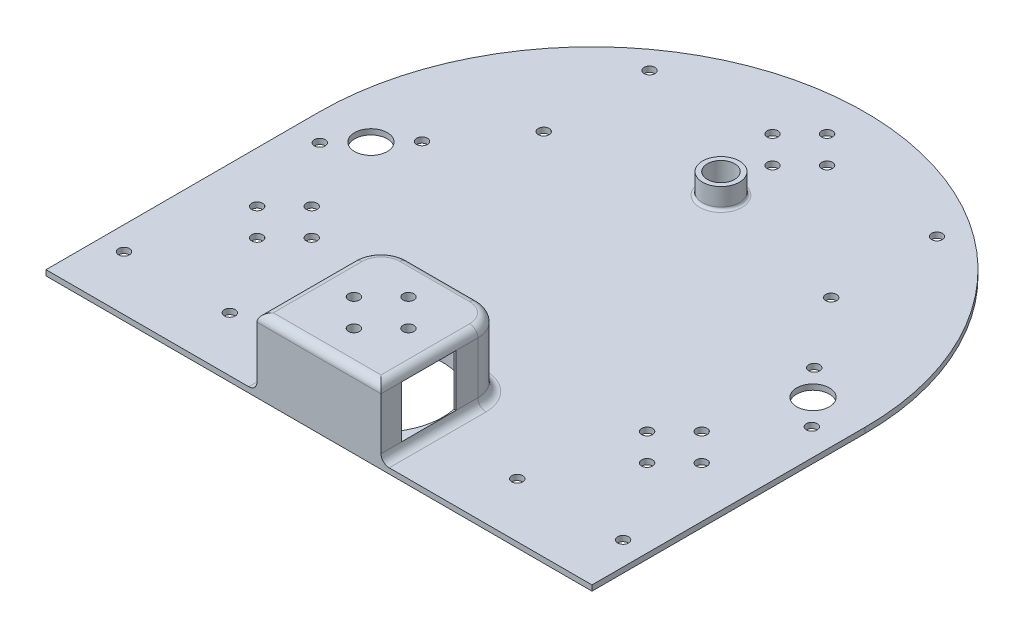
SolidWorks part; units mm, degrees
ref_plane "Front Plane" through (0, 0, 0) normal (0, 0, 1) x (1, 0, 0)
ref_plane "Top Plane" through (0, 0, 0) normal (0, 1, 0) x (1, 0, 0)
ref_plane "Right Plane" through (0, 0, 0) normal (1, 0, 0) x (0, 0, -1)
sketch "Sketch1" plane through (0, 0, 0) normal (0, 1, 0) x (1, 0, 0)
  line L0 (-100.1, 0) -> (-100.1, -100.1)
  line L1 (-100.1, -100.1) -> (100.1, -100.1)
  line L2 (100.1, -100.1) -> (100.1, 0)
  arc A0 (100.1, 0) -> (-100.1, 0) centre (0, 0) ccw
  dimension "D1" = 200.2
extrude "Boss-Extrude1" add sketch "Sketch1" along normal blind 2
sketch "Sketch2" plane through (0, 2, 0) normal (0, 1, 0) x (1, 0, 0)
  line L0 (0, 0) -> (0, 100.1) construction
  line L1 (0, 0) -> (-100.1, -57.7928) construction
  line L2 (-100.1, 0) -> (-100.1, -100.1) construction
  line L3 (0, 0) -> (100.1, -57.7928) construction
  line L4 (100.1, -100.1) -> (100.1, 0) construction
  line L5 (-100.1, 0) -> (100.1, 0) construction
  line L6 (0, 0) -> (0, -100.1) construction
  line L7 (-100.1, -100.1) -> (100.1, -100.1) construction
  arc A0 (100.1, 0) -> (-100.1, 0) centre (0, 0) ccw construction
  circle A1 centre (0, 76.2) radius 10
  circle A2 centre (71.4904, -41.275) radius 10
  circle A3 centre (-71.4904, -41.275) radius 10
  circle A4 centre (-71.4904, -31.275) radius 2
  circle A5 centre (-61.4904, -41.275) radius 2
  circle A6 centre (-71.4904, -51.275) radius 2
  circle A7 centre (-81.4904, -41.275) radius 2
  circle A8 centre (61.4904, -41.275) radius 2
  circle A9 centre (71.4904, -31.275) radius 2
  circle A10 centre (81.4904, -41.275) radius 2
  circle A11 centre (71.4904, -51.275) radius 2
  circle A12 centre (0, 66.2) radius 2
  circle A13 centre (-10, 76.2) radius 2
  circle A14 centre (0, 86.2) radius 2
  circle A15 centre (10, 76.2) radius 2
  circle A16 centre (-81.05, 0) radius 6
  circle A17 centre (81.05, 0) radius 6
  circle A18 centre (0, -77.2975) radius 10
  circle A19 centre (0, -67.2975) radius 2
  circle A20 centre (10, -77.2975) radius 2
  circle A21 centre (0, -87.2975) radius 2
  circle A22 centre (-10, -77.2975) radius 2
  dimension "D3" = 4
  dimension "D7" = 20
  dimension "D8" = 12
  dimension "D12" = 20
  dimension "D13" = 4
  dimension "D1" = 120
  dimension "D2" = 120
  dimension "D4" = 76.2
  dimension "D5" = 82.55
  dimension "D6" = 82.55
  dimension "D9" = 19.05
  dimension "D10" = 19.05
  dimension "D11" = 112
extrude "Cut-Extrude1" cut sketch "Sketch2" against normal blind 5 contours A3 A7 | A3 A6 | A3 A6 | A3 A5 | A3 A5 | A3 A4 | A3 A4 | A16 | A17 | A2 A11 | A2 A11 | A2 A10 | A2 A10 | A2 A8 | A2 A8 | A2 A9 | A2 A9 | A1 A14 | A1 A14 | A1 A15 | A1 A15 | A1 A12 | A1 A12 | A1 A13 | A1 A13 | A20 | A19 | A22 | A21
sketch "Sketch4" plane through (0, 2, 0) normal (0, 1, 0) x (1, 0, 0)
  line L0 (0, 0) -> (0, 100.1) construction
  arc A0 (100.1, 0) -> (-100.1, 0) centre (0, 0) ccw construction
  circle A1 centre (0, 47.3) radius 5
  dimension "D1" = 10
  dimension "D2" = 52.8
extrude "Cut-Extrude2" cut sketch "Sketch4" against normal blind 5
sketch "Sketch5" plane through (0, 2, 0) normal (0, 1, 0) x (1, 0, 0)
  circle A0 centre (0, 47.3) radius 5
  circle A1 centre (0, 47.3) radius 6.75
  dimension "D1" = 10
  dimension "D2" = 13.5
extrude "Boss-Extrude2" add sketch "Sketch5" along normal mid plane 15
sketch "Sketch8" plane through (0, 2, 0) normal (0, 1, 0) x (1, 0, 0)
  line L0 (-81.05, 0) -> (-70.5251, 11.0358) construction
  line L1 (-81.05, 0) -> (-91.5749, -11.0358) construction
  line L2 (-10, -77.2975) -> (10, -77.2975) construction
  line L3 (0, -67.2975) -> (0, -87.2975) construction
  line L4 (-81.05, 0) -> (0, -77.2975) construction
  line L5 (81.05, 0) -> (0, -77.2975) construction
  line L6 (81.05, 0) -> (91.5749, -11.0358) construction
  line L7 (81.05, 0) -> (70.5251, 11.0358) construction
  circle A0 centre (-71.9054, 9.5885) radius 2
  circle A1 centre (-90.1946, -9.5885) radius 2
  circle A2 centre (71.9054, 9.5885) radius 2
  circle A3 centre (90.1946, -9.5885) radius 2
  dimension "D2" = 4
  dimension "D1" = 13.25
extrude "Cut-Extrude3" cut sketch "Sketch8" against normal through all
sketch "Sketch9" plane through (0, 2, 0) normal (0, 1, 0) x (1, 0, 0)
  line L0 (0, -67.2975) -> (0, -87.2975) construction
  line L1 (-10, -77.2975) -> (10, -77.2975) construction
  circle A0 centre (0, -77.2975) radius 22.5
  dimension "D1" = 45
extrude "Cut-Extrude4" cut sketch "Sketch9" against normal through all
sketch "Sketch10" plane through (0, 2, 0) normal (0, 1, 0) x (1, 0, 0)
  line L0 (-100.1, -100.1) -> (100.1, -100.1) construction
  line L1 (-22.75, -64.6) -> (-22.75, -100.1)
  line L2 (22.75, -64.6) -> (22.75, -100.1)
  line L3 (-22.75, -100.1) -> (22.75, -100.1)
  line L4 (-12.75, -54.6) -> (12.75, -54.6)
  arc A0 (-22.75, -64.6) -> (-12.75, -54.6) centre (-12.75, -64.6) cw
  arc A1 (22.75, -64.6) -> (12.75, -54.6) centre (12.75, -64.6) ccw
  point P0 (0, -54.6)
  point P9 (-22.75, -54.6)
  point P13 (22.75, -54.6)
  dimension "D3" = 10
  dimension "D1" = 45.5
  dimension "D2" = 45.5
extrude "Boss-Extrude3" add sketch "Sketch10" along normal blind 25
sketch "Sketch11" plane through (0, 2, 0) normal (0, -1, 0) x (1, 0, 0)
  circle A0 centre (0, 77.2975) radius 22.5
extrude "Cut-Extrude5" cut sketch "Sketch11" against normal blind 21
sketch "Sketch12" plane through (0, 23, 0) normal (0, -1, 0) x (1, 0, 0)
  circle A0 centre (0, 77.2975) radius 10
  circle A1 centre (0, 87.2975) radius 2
  circle A2 centre (10, 77.2975) radius 2
  circle A3 centre (0, 67.2975) radius 2
  circle A4 centre (-10, 77.2975) radius 2
  dimension "D1" = 20
  dimension "D2" = 4
extrude "Cut-Extrude6" cut sketch "Sketch12" against normal blind 20 contours A0 A4 | A0 A4 | A0 A3 | A0 A3 | A0 A2 | A0 A2 | A0 A1 | A0 A1
fillet "Fillet3" radius 3 11 edges at (-22.75, 2, 82.35) (22.75, 2, 82.35) (0, 2, 54.6) (-22.75, 27, 82.35) (0, 27, 54.6) (22.75, 27, 82.35) (0, 27, 100.1) (19.8211, 2, 57.5289) (-19.8211, 2, 57.5289) (-19.8211, 27, 57.5289) (19.8211, 27, 57.5289)
fillet "Fillet5" radius 1 2 edges at (0, 2, -40.55) (0, 0, -40.55)
sketch "Sketch15" plane through (0, 2, 0) normal (0, 1, 0) x (1, 0, 0)
  line L0 (-91.5, -80.1) -> (-52.7, -80.1) construction
  line L1 (0, 0) -> (0, -100.1) construction
  line L2 (22.75, -100.1) -> (-22.75, -100.1) construction
  line L3 (-100.1, -100.1) -> (-25.75, -100.1) construction
  line L4 (-100.1, 0) -> (-100.1, -100.1) construction
  line L5 (-52.7, 73.8) -> (-52.7, 35) construction
  circle A0 centre (-91.5, -80.1) radius 2
  circle A1 centre (-52.7, -80.1) radius 2
  circle A2 centre (52.7, -80.1) radius 2
  circle A3 centre (91.5, -80.1) radius 2
  circle A4 centre (-52.7, 73.8) radius 2
  circle A5 centre (-52.7, 35) radius 2
  circle A6 centre (52.7, 35) radius 2
  circle A7 centre (52.7, 73.8) radius 2
  point P11 (-72.1, -80.1)
  dimension "D2" = 4
  dimension "D1" = 38.8
  dimension "D3" = 20
  dimension "D4" = 28
  dimension "D5" = 38.8
  dimension "D6" = 35
extrude "Cut-Extrude8" cut sketch "Sketch15" against normal through all
sketch "Sketch17" plane through (22.75, 0, 0) normal (1, 0, 0) x (0, 0, -1)
  line L0 (-64.6, 24) -> (-100.1, 24) construction
  line L1 (-92.6, 24) -> (-72.6, 24)
  line L2 (-92.6, 24) -> (-92.6, 5)
  line L3 (-92.6, 5) -> (-72.6, 5)
  line L4 (-72.6, 24) -> (-72.6, 5)
  line L5 (-100.1, 5) -> (-64.6, 5) construction
  line L6 (-64.6, 24) -> (-64.6, 5) construction
  dimension "D1" = 20
  dimension "D2" = 8
extrude "Cut-Extrude10" cut sketch "Sketch17" against normal through all
